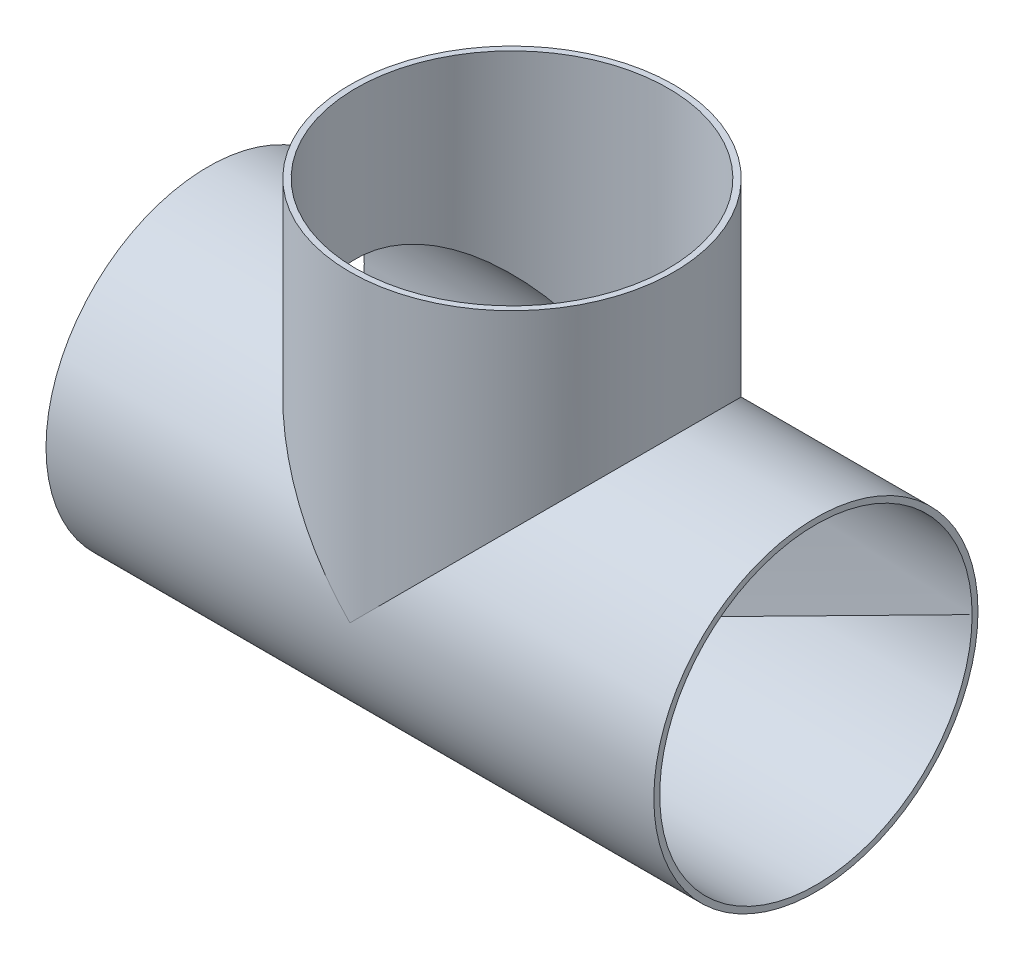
SolidWorks part; units mm, degrees
ref_plane "Front Plane" through (0, 0, 0) normal (0, 0, 1) x (1, 0, 0)
ref_plane "Top Plane" through (0, 0, 0) normal (0, 1, 0) x (1, 0, 0)
ref_plane "Right Plane" through (0, 0, 0) normal (1, 0, 0) x (0, 0, -1)
sketch "Sketch1" plane through (0, 0, 0) normal (1, 0, 0) x (0, 0, -1)
  circle A0 centre (0, 0) radius 76.2
  dimension "D1" = 152.4
extrude "Boss-Extrude1" add sketch "Sketch1" along normal mid plane 285.75
sketch "Sketch2" plane through (0, 0, 0) normal (0, 1, 0) x (1, 0, 0)
  circle A0 centre (0, 0) radius 76.2
  dimension "D1" = 152.4
extrude "Boss-Extrude2" add sketch "Sketch2" along normal blind 142.875
sketch "Sketch3" plane through (0, 0, 0) normal (0, 1, 0) x (1, 0, 0)
  circle A0 centre (0, 0) radius 73.4314
  dimension "D1" = 146.8628
extrude "Cut-Extrude1" cut sketch "Sketch3" along normal blind 142.875
sketch "Sketch4" plane through (0, 0, 0) normal (1, 0, 0) x (0, 0, -1)
  circle A0 centre (0, 0) radius 73.4314
  dimension "D1" = 146.8628
extrude "Cut-Extrude2" cut sketch "Sketch4" against normal mid plane 285.75
